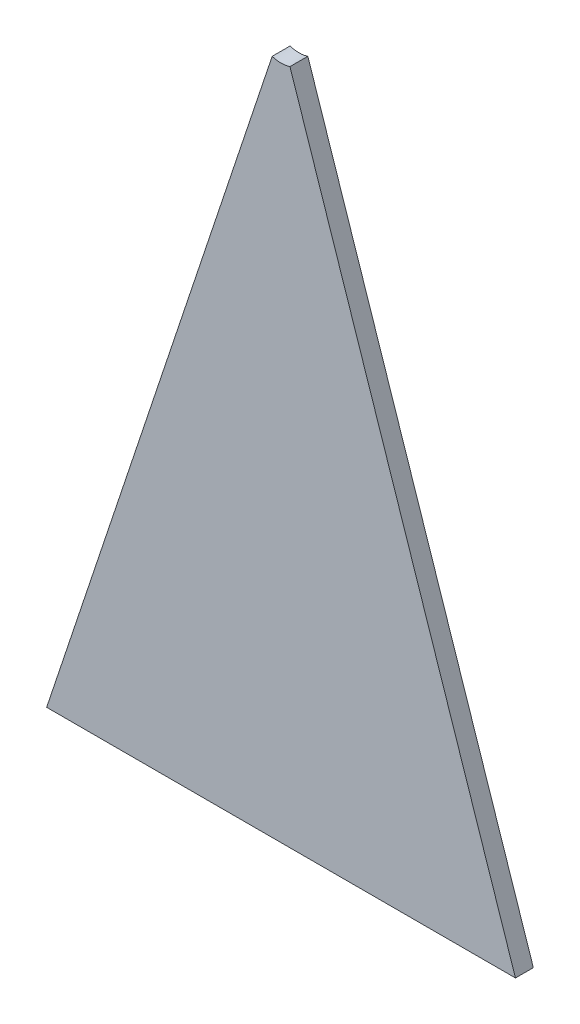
SolidWorks part; units mm, degrees
ref_plane "Front Plane" through (0, 0, 0) normal (0, 0, 1) x (1, 0, 0)
ref_plane "Top Plane" through (0, 0, 0) normal (0, 1, 0) x (1, 0, 0)
ref_plane "Right Plane" through (0, 0, 0) normal (1, 0, 0) x (0, 0, -1)
sketch "Sketch1" plane through (0, 0, 0) normal (0, 0, 1) x (1, 0, 0)
  line L0 (0, 0) -> (240.5132, 721.5395)
  line L1 (259.4868, 721.5395) -> (500, 0)
  line L2 (500, 0) -> (0, 0)
  line L3 (240.5132, 721.5395) -> (250, 750) construction
  line L4 (250, 750) -> (259.4868, 721.5395) construction
  arc A0 (240.5132, 721.5395) -> (259.4868, 721.5395) centre (250, 750) ccw
  arc A1 (259.4868, 721.5395) -> (240.5132, 721.5395) centre (250, 750) ccw construction
  point P5 (250, 0)
  dimension "D3" = 30
  dimension "D1" = 750
  dimension "D2" = 500
extrude "Boss-Extrude1" add sketch "Sketch1" along normal blind 19.05
